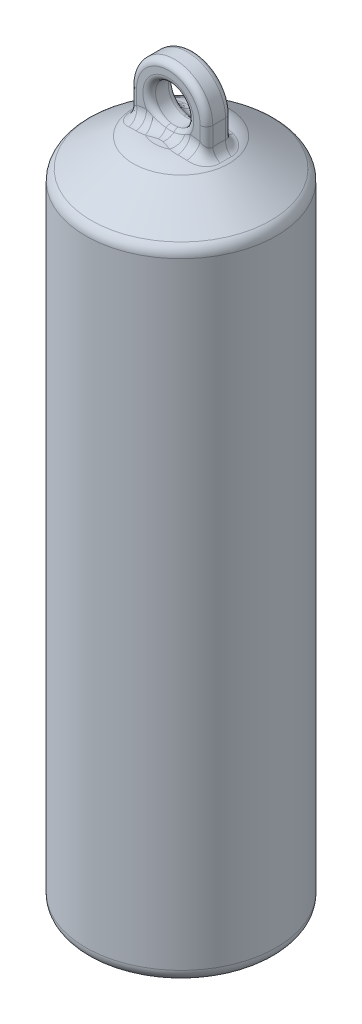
SolidWorks part; units mm, degrees
ref_plane "Спереди" through (0, 0, 0) normal (0, 0, 1) x (1, 0, 0)
ref_plane "Сверху" through (0, 0, 0) normal (0, 1, 0) x (1, 0, 0)
ref_plane "Справа" through (0, 0, 0) normal (1, 0, 0) x (0, 0, -1)
sketch "Эскиз1" plane through (0, 0, 0) normal (0, 0, 1) x (1, 0, 0)
  line L0 (0, 0) -> (-13, 0)
  line L1 (-15, 2) -> (-15, 98.9366)
  line L2 (-14.1184, 100.5947) -> (-6, 106.0706)
  line L3 (-6, 106.0706) -> (0, 106.0706)
  line L4 (0, 106.0706) -> (0, 0)
  line L5 (-15, 100) -> (0, 100) construction
  arc A0 (-13, 0) -> (-15, 2) centre (-13, 2) cw
  arc A1 (-15, 98.9366) -> (-14.1184, 100.5947) centre (-13, 98.9366) cw
  point P9 (-15, 0)
  dimension "D5" = 2
  dimension "D1" = 100
  dimension "D2" = 15
  dimension "D3" = 34
  dimension "D4" = 6
revolve "Повернуть1" add sketch "Эскиз1" angle 360 about L4
fillet "Скругление5" radius 6 1 edges at (-6, 106.0706, 0)
sketch "Эскиз2" plane through (0, 0, 0) normal (0, 0, 1) x (1, 0, 0)
  line L0 (-6, 110) -> (-6, 103)
  line L2 (6, 103) -> (6, 110)
  line L4 (-6, 103) -> (6, 103)
  line L6 (0, 116) -> (0, 103) construction
  circle A0 centre (0, 110) radius 3
  arc A1 (6, 110) -> (-6, 110) centre (0, 110) ccw
  dimension "D1" = 6
  dimension "D2" = 12
  dimension "D3" = 110
  dimension "D4" = 7
extrude "Бобышка-Вытянуть1" add sketch "Эскиз2" along normal mid plane 4
fillet "Скругление1" radius 1 8 edges at (-6, 107.8343, -2) (-6, 107.8343, 2) (0, 116, 2) (3, 110, -2) (3, 110, 2) (0, 116, -2) (6, 107.8343, -2) (6, 107.8343, 2)
fillet "Скругление2" radius 2 16 edges at (-5.6349, 105.8123, 1.7726) (-5.7959, 105.7787, -1.6054) (0, 106.0706, -2) (2.2011, 106.0706, -2) (-2.2011, 106.0706, -2) (-2.2011, 106.0706, 2) (2.2011, 106.0706, 2) (0, 106.0706, 2) (5.6349, 105.8123, -1.7726) (-6, 94.5615, -2.6087) (5.7959, 105.7787, 1.6054)
